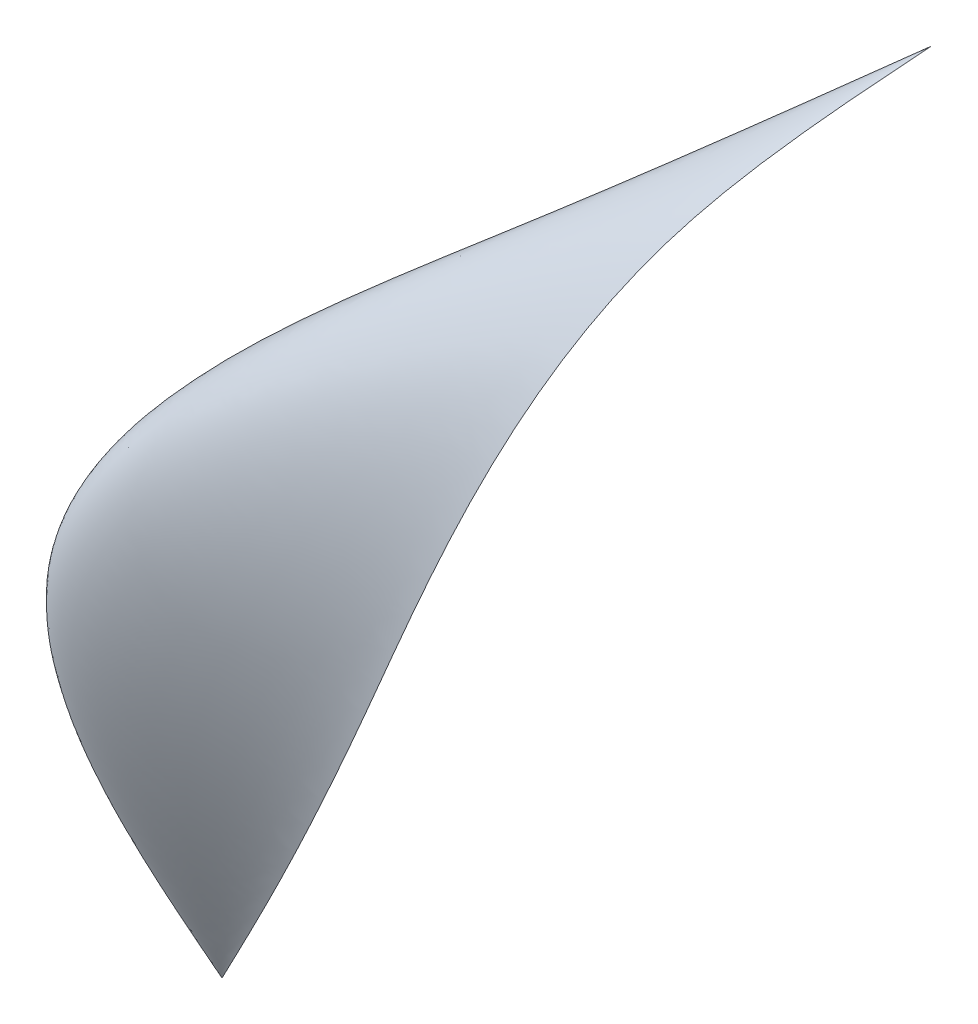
SolidWorks part; units mm, degrees
ref_plane "Front XY" through (0, 0, 0) normal (0, 0, 1) x (1, 0, 0)
ref_plane "Top XZ" through (0, 0, 0) normal (0, 1, 0) x (1, 0, 0)
ref_plane "Right YZ" through (0, 0, 0) normal (1, 0, 0) x (0, 0, -1)
sketch3d "3DSketch1"
  spline S0 degree 3 poles (0, 0, 0) (-2.7888, 10.3952, 3.6115) (-8.9803, 33.4742, 11.6297) (19.8941, 55.405, 3.2612) (33.0929, 65.9298, -7.5532) (38.1776, 69.9844, -11.7193) knots 0 0 0 0 0.335032 0.743827 1 1 1 1
sketch3d "3DSketch2"
  spline S0 degree 3 poles (0, 0, 0) (6.6795, 9.2559, 3.8509) (19.8747, 27.5407, 11.4583) (28.977, 58.8755, 6.0327) (35.9767, 67.327, -7.4728) (38.1776, 69.9844, -11.7193) knots 0 0 0 0 0.412735 0.815347 1 1 1 1
surface "Surface-Loft1"
